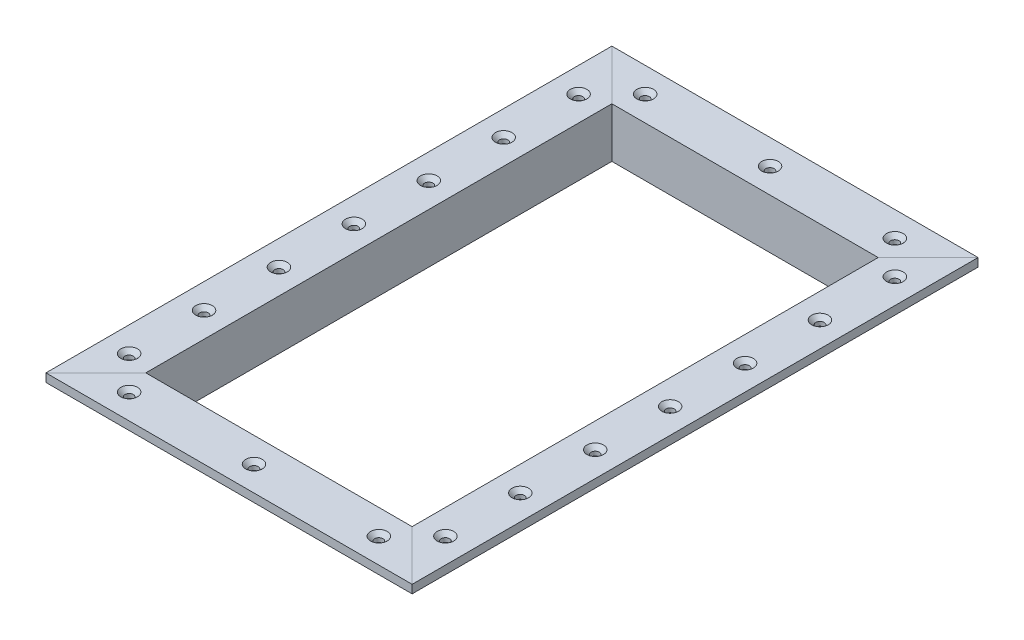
SolidWorks part; units mm, degrees
ref_plane "Front Plane" through (0, 0, 0) normal (0, 0, 1) x (1, 0, 0)
ref_plane "Top Plane" through (0, 0, 0) normal (0, 1, 0) x (1, 0, 0)
ref_plane "Right Plane" through (0, 0, 0) normal (1, 0, 0) x (0, 0, -1)
sketch "Sketch1" plane through (0, 0, 0) normal (0, 0, 1) x (1, 0, 0)
  line L0 (0, 0) -> (19.05, 0)
  line L1 (19.05, 0) -> (19.05, -19.05)
  line L2 (0, -3.175) -> (15.875, -3.175)
  line L3 (15.875, -3.175) -> (15.875, -19.05)
  line L4 (0, 0) -> (0, -3.175)
  line L5 (15.875, -19.05) -> (19.05, -19.05)
  line L6 (69.85, 0) -> (69.85, -19.05) construction
  line L7 (123.825, -19.05) -> (120.65, -19.05)
  line L8 (139.7, 0) -> (139.7, -3.175)
  line L9 (123.825, -3.175) -> (123.825, -19.05)
  line L10 (139.7, -3.175) -> (123.825, -3.175)
  line L11 (120.65, 0) -> (120.65, -19.05)
  line L12 (139.7, 0) -> (120.65, 0)
  dimension "D1" = 19.05
  dimension "D2" = 19.05
  dimension "D4" = 101.6
  dimension "D3" = 3.175
extrude "Boss-Extrude1" add sketch "Sketch1" along normal mid plane 177.8
sketch "Sketch2" plane through (0, 0, 0) normal (0, 1, 0) x (1, 0, 0)
  line L0 (139.7, -88.9) -> (139.7, 88.9) construction
  line L1 (0, 88.9) -> (139.7, 88.9)
  line L2 (0, 88.9) -> (0, 107.95)
  line L3 (0, 107.95) -> (139.7, 107.95)
  line L4 (139.7, 88.9) -> (139.7, 107.95)
  line L5 (0, -88.9) -> (139.7, -88.9)
  line L6 (0, -88.9) -> (0, -107.95)
  line L7 (0, -107.95) -> (139.7, -107.95)
  line L8 (139.7, -88.9) -> (139.7, -107.95)
  dimension "D1" = 19.05
  dimension "D2" = 19.05
extrude "Boss-Extrude2" add sketch "Sketch2" against normal up to surface (3.175 mm away)
sketch "Sketch3" plane through (0, -3.175, 0) normal (0, -1, 0) x (1, 0, 0)
  line L0 (123.825, 88.9) -> (123.825, -88.9) construction
  line L1 (15.875, 88.9) -> (123.825, 88.9)
  line L2 (15.875, 88.9) -> (15.875, 92.075)
  line L3 (15.875, 92.075) -> (123.825, 92.075)
  line L4 (123.825, 88.9) -> (123.825, 92.075)
  line L6 (15.875, -88.9) -> (123.825, -88.9)
  line L7 (15.875, -88.9) -> (15.875, -92.075)
  line L8 (15.875, -92.075) -> (123.825, -92.075)
  line L9 (123.825, -88.9) -> (123.825, -92.075)
  dimension "D1" = 3.175
  dimension "D2" = 3.175
extrude "Boss-Extrude3" add sketch "Sketch3" along normal up to surface (15.875 mm away)
sketch "Sketch4" plane through (0, 0, 0) normal (0, 1, 0) x (1, 0, 0)
  line L0 (0, 0) -> (139.7, 0) construction
  line L1 (139.7, -107.95) -> (139.7, 107.95) construction
  line L2 (69.85, 107.95) -> (69.85, -107.95) construction
  line L3 (139.7, 107.95) -> (0, 107.95) construction
  line L4 (0, -107.95) -> (139.7, -107.95) construction
  line L5 (0, 107.95) -> (19.05, 88.9) construction
  line L6 (19.05, 88.9) -> (24.6324, 83.3176) construction
  line L7 (-0.018, 107.932) -> (19.032, 88.882)
  line L8 (19.032, 88.882) -> (24.6144, 83.2996)
  line L9 (0.018, 107.968) -> (19.068, 88.918)
  line L10 (19.068, 88.918) -> (24.6504, 83.3356)
  line L11 (-0.018, 107.932) -> (0.018, 107.968)
  line L12 (24.6144, 83.2996) -> (24.6504, 83.3356)
  line L13 (120.65, 88.9) -> (115.0676, 83.3176) construction
  line L14 (139.7, 107.95) -> (120.65, 88.9) construction
  line L15 (115.0856, 83.2996) -> (115.0496, 83.3356)
  line L16 (139.718, 107.932) -> (139.682, 107.968)
  line L17 (120.632, 88.918) -> (115.0496, 83.3356)
  line L18 (139.682, 107.968) -> (120.632, 88.918)
  line L19 (120.668, 88.882) -> (115.0856, 83.2996)
  line L20 (139.718, 107.932) -> (120.668, 88.882)
  line L21 (139.7, -107.95) -> (120.65, -88.9) construction
  line L22 (120.65, -88.9) -> (115.0676, -83.3176) construction
  line L23 (19.05, -88.9) -> (24.6324, -83.3176) construction
  line L24 (0, -107.95) -> (19.05, -88.9) construction
  line L25 (139.718, -107.932) -> (120.668, -88.882)
  line L26 (120.668, -88.882) -> (115.0856, -83.2996)
  line L27 (139.682, -107.968) -> (120.632, -88.918)
  line L28 (120.632, -88.918) -> (115.0496, -83.3356)
  line L29 (139.718, -107.932) -> (139.682, -107.968)
  line L30 (115.0856, -83.2996) -> (115.0496, -83.3356)
  line L31 (24.6144, -83.2996) -> (24.6504, -83.3356)
  line L32 (-0.018, -107.932) -> (0.018, -107.968)
  line L33 (19.068, -88.918) -> (24.6504, -83.3356)
  line L34 (0.018, -107.968) -> (19.068, -88.918)
  line L35 (19.032, -88.882) -> (24.6144, -83.2996)
  line L36 (-0.018, -107.932) -> (19.032, -88.882)
  dimension "D1" = 0.0254
  dimension "D2" = 0.0254
extrude "Cut-Extrude1" cut sketch "Sketch4" against normal through all
ref_plane "Plane1" through (69.85, 0, 0) normal (-1, 0, 0) x (0, 0, 1)
sketch "Sketch5" plane through (0, 0, 0) normal (0, 1, 0) x (1, 0, 0)
  line L1 (9.525, 98.425) -> (130.175, 98.425) construction
  line L2 (9.525, 98.425) -> (9.525, -98.425) construction
  line L3 (9.525, -98.425) -> (130.175, -98.425) construction
  line L4 (130.175, 98.425) -> (130.175, -98.425) construction
  line L5 (9.525, 98.425) -> (130.175, -98.425) construction
  line L6 (9.525, -98.425) -> (130.175, 98.425) construction
  line L7 (139.7, -107.9141) -> (139.7, 107.9141) construction
  line L8 (139.6641, 107.95) -> (0.0359, 107.95) construction
  line L9 (9.525, 85.725) -> (9.525, 98.425) construction
  line L10 (9.525, -85.725) -> (9.525, -98.425) construction
  line L11 (69.85, 0) -> (69.85, -70.8587) construction
  line L12 (69.85, 0) -> (35.3731, 0) construction
  point P0 (69.85, 0)
  point P8 (22.225, 98.425)
  point P9 (69.85, 98.425)
  point P12 (117.475, 98.425)
  point P14 (9.525, 85.725)
  point P15 (9.525, 57.15)
  point P16 (9.525, 28.575)
  point P17 (9.525, 0)
  point P18 (9.525, -28.575)
  point P19 (9.525, -57.15)
  point P20 (9.525, -85.725)
  point P21 (117.475, -98.425)
  point P24 (69.85, -98.425)
  point P28 (22.225, -98.425)
  point P29 (130.175, -85.725)
  point P30 (130.175, -57.15)
  point P31 (130.175, -28.575)
  point P32 (130.175, 0)
  point P33 (130.175, 28.575)
  point P34 (130.175, 57.15)
  point P35 (130.175, 85.725)
  point P36 (0, 0)
  point P37 (0, 0)
  dimension "D1" = 9.525
  dimension "D2" = 9.525
  dimension "D3" = 12.7
  dimension "D4" = 12.7
  dimension "D5" = 7
  dimension "D6" = 12.7
ref_plane "Plane2" through (22.225, 0, 0) normal (-1, 0, 0) x (0, 0, 1)
sketch "Sketch6" plane through (22.225, 0, 0) normal (-1, 0, 0) x (0, 0, 1)
  line L0 (-98.425, 0) -> (-95.25, 0)
  line L1 (98.425, 0) -> (-98.425, 0) construction
  line L2 (-95.25, 0) -> (-96.8375, -1.5875)
  line L3 (-96.8375, -1.5875) -> (-96.8375, -4.2793)
  line L4 (-96.8375, -4.2793) -> (-98.425, -4.2793)
  line L5 (-98.425, -4.2793) -> (-98.425, 0)
  line L6 (107.9141, -3.175) -> (-107.9141, -3.175) construction
  dimension "D1" = 1.5875
  dimension "D2" = 3.175
  dimension "D3" = 1.5875
  dimension "D4" = 1.1043
revolve "Cut-Revolve1" cut sketch "Sketch6" angle 360 about L5
sketch "Sketch7" plane through (0, 0, 0) normal (0, 1, 0) x (1, 0, 0)
  point P0 (69.85, 98.425)
  point P2 (117.475, 98.425)
  point P4 (9.525, 85.725)
  point P6 (9.525, 57.15)
  point P8 (9.525, 28.575)
  point P10 (9.525, 0)
  point P12 (9.525, -28.575)
  point P14 (9.525, -57.15)
  point P16 (9.525, -85.725)
  point P18 (22.225, -98.425)
  point P20 (117.475, -98.425)
  point P22 (130.175, -85.725)
  point P24 (130.175, -57.15)
  point P26 (130.175, -28.575)
  point P28 (130.175, 0)
  point P30 (130.175, 28.575)
  point P32 (130.175, 57.15)
  point P34 (130.175, 85.725)
  point P36 (69.85, -98.425)
  point P38 (0, 0)
pattern_sketch "Sketch-Pattern2" of "Cut-Revolve1"
